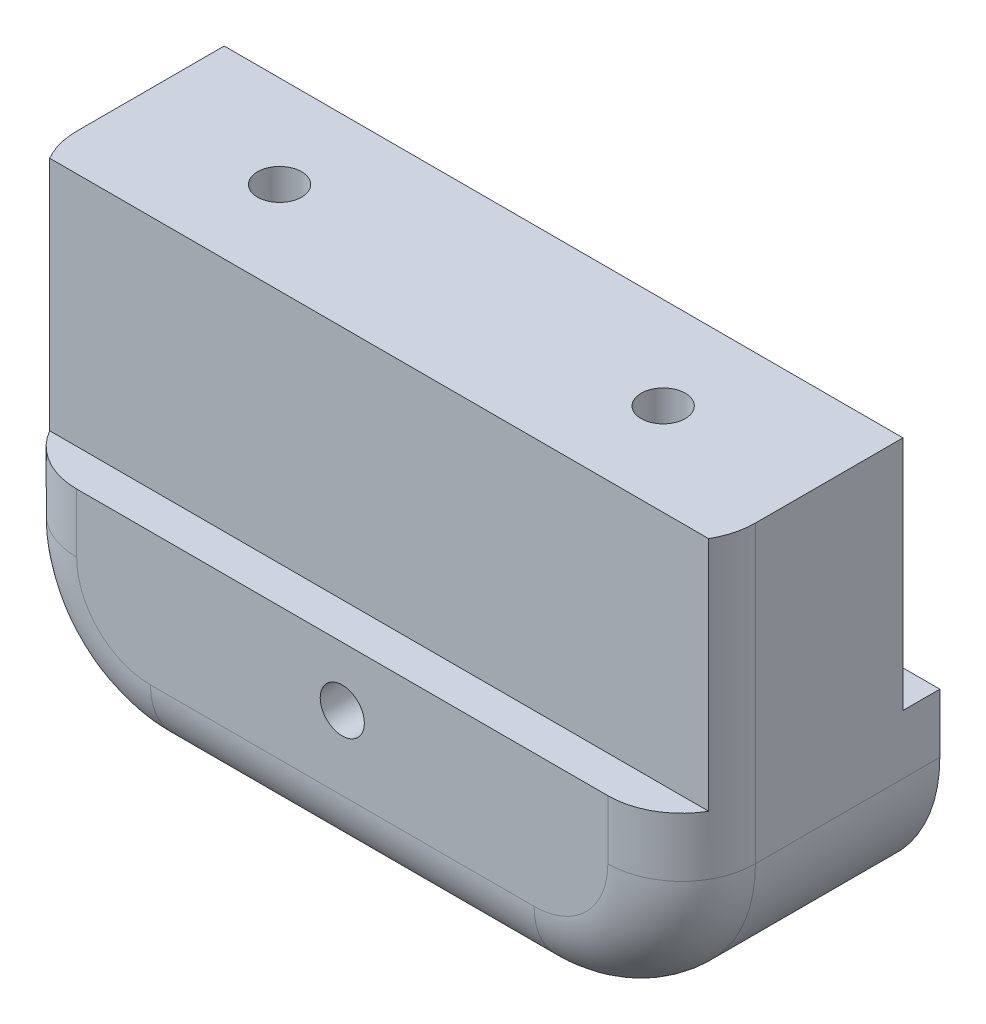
SolidWorks part; units mm, degrees
ref_plane "Front Plane" through (0, 0, 0) normal (0, 0, 1) x (1, 0, 0)
ref_plane "Top Plane" through (0, 0, 0) normal (0, 1, 0) x (1, 0, 0)
ref_plane "Right Plane" through (0, 0, 0) normal (1, 0, 0) x (0, 0, -1)
sketch "Sketch1" plane through (0, 0, 0) normal (0, 0, 1) x (1, 0, 0)
  line L0 (161.925, -178.562) -> (85.725, -178.562) construction
  line L1 (174.625, -149.225) -> (174.625, -165.862) construction
  line L2 (161.925, -178.562) -> (85.725, -178.562)
  line L3 (174.625, -149.225) -> (174.625, -165.862)
  line L4 (85.725, -178.562) -> (75.565, -178.562)
  line L5 (75.565, -178.562) -> (75.565, -140.462)
  line L6 (-174.625, -140.462) -> (174.625, -140.462) construction
  line L7 (75.565, -140.462) -> (174.625, -140.462)
  line L8 (174.625, -140.462) -> (174.625, -149.225)
  arc A0 (161.925, -178.562) -> (174.625, -165.862) centre (161.925, -165.862) ccw construction
  arc A1 (161.925, -178.562) -> (174.625, -165.862) centre (161.925, -165.862) ccw
  dimension "D1" = 99.06
extrude "Boss-Extrude1" add sketch "Sketch1" along normal blind 22.225
hole_wizard "#10-24 Tapped Hole2" positions "Sketch3" profile "Sketch2" tap size "#10-24" standard "ANSI Inch"
sketch "Sketch3" plane through (0, 0, 0) normal (0, 0, -1) x (-1, 0, 0)
  point P0 (-145.415, -165.862)
sketch "Sketch2" plane through (145.415, -165.862, 0) normal (1, 0, 0) x (0, 1, 0)
  line L0 (0, 0) -> (0, 22.225)
  line L1 (0, 22.225) -> (1.8986, 22.225)
  line L2 (1.8986, 22.225) -> (1.8986, 0)
  line L5 (1.8986, 0) -> (0, 0)
  line L11 (0, -6.35) -> (0, 107.95) construction
  dimension "Thru Tap Drill Dia." = 3.7973
  dimension "Thru Tap Drill Depth" = 22.225
sketch "Sketch4" plane through (0, 0, 22.225) normal (0, 0, -1) x (-1, 0, 0)
  line L0 (-174.625, -165.862) -> (-174.625, -140.462) construction
  line L1 (-174.625, -160.782) -> (-75.565, -160.782)
  line L2 (-174.625, -160.782) -> (-174.625, -140.462)
  line L3 (-174.625, -140.462) -> (-75.565, -140.462)
  line L4 (-75.565, -160.782) -> (-75.565, -140.462)
  line L5 (-75.565, -140.462) -> (-75.565, -178.562) construction
  circle A1 centre (-145.415, -165.862) radius 1.8987 construction
  dimension "D1" = 5.08
extrude "Cut-Extrude2" cut sketch "Sketch4" along normal blind 3.175
sketch "Sketch5" plane through (0, 0, 0) normal (0, 0, -1) x (-1, 0, 0)
  line L0 (-145.415, -185.9996) -> (-145.415, -130.9435) construction
  line L1 (-116.205, -133.2845) -> (-64.617, -133.2845)
  line L2 (-116.205, -133.2845) -> (-116.205, -187.04)
  line L3 (-116.205, -187.04) -> (-64.617, -187.04)
  line L4 (-64.617, -133.2845) -> (-64.617, -187.04)
  line L5 (-174.625, -165.862) -> (-174.625, -140.462) construction
extrude "Cut-Extrude3" cut sketch "Sketch5" against normal through all
fillet "Fillet3" radius 12.7 1 edges at (116.205, -178.562, 11.1125)
fillet "Fillet4" radius 6.35 5 edges at (116.205, -163.322, 22.225) (119.9247, -174.8423, 22.225) (174.625, -163.322, 22.225) (170.9053, -174.8423, 22.225) (145.415, -178.562, 22.225)
sketch "Sketch6" plane through (0, 0, 0) normal (0, 0, -1) x (-1, 0, 0)
  line L2 (-175.8387, -139.1358) -> (-111.6166, -139.1358)
  line L3 (-175.8387, -139.1358) -> (-175.8387, -160.782)
  line L4 (-175.8387, -160.782) -> (-111.6166, -160.782)
  line L5 (-111.6166, -139.1358) -> (-111.6166, -160.782)
extrude "Cut-Extrude4" cut sketch "Sketch6" against normal blind 3.175
hole_wizard "#10-24 Tapped Hole3" positions "Sketch8" profile "Sketch9" tap size "#10-24" standard "ANSI Inch"
sketch "Sketch8" plane through (0, -140.462, 0) normal (0, 1, 0) x (1, 0, 0)
  line L0 (111.77, -11.1125) -> (180.5428, -11.1125) construction
  line L1 (116.205, -3.175) -> (174.625, -3.175) construction
  line L2 (117.0557, -19.05) -> (173.7743, -19.05) construction
  line L3 (116.205, -3.175) -> (116.205, -15.875) construction
  line L4 (174.625, -15.875) -> (174.625, -3.175) construction
  point P8 (128.905, -11.1125)
  point P10 (161.925, -11.1125)
  dimension "D1" = 12.7
  dimension "D2" = 12.7
sketch "Sketch9" plane through (128.905, -140.462, 11.1125) normal (1, 0, 0) x (0, 0, 1)
  line L0 (0, 0) -> (0, 38.1)
  line L1 (0, 38.1) -> (1.8986, 38.1)
  line L2 (1.8986, 38.1) -> (1.8986, 0)
  line L5 (1.8986, 0) -> (0, 0)
  line L11 (0, -6.35) -> (0, 107.95) construction
  dimension "Thru Tap Drill Dia." = 3.7973
  dimension "Thru Tap Drill Depth" = 38.1
